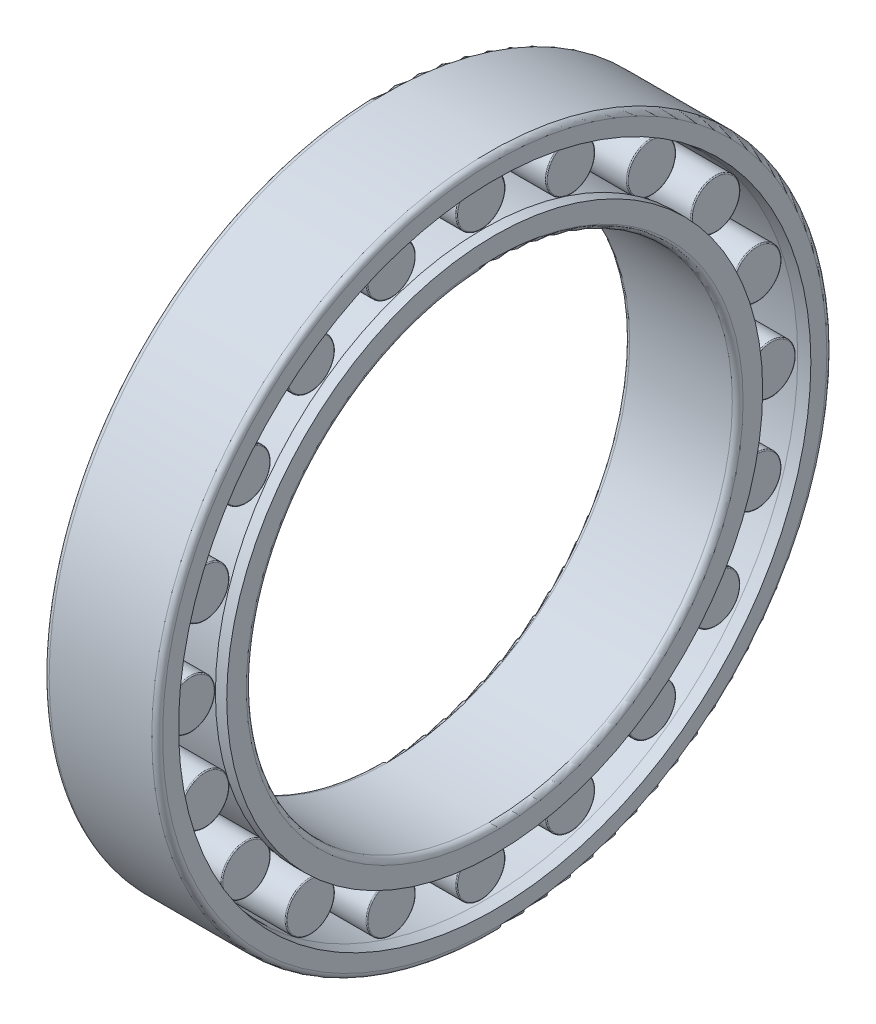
SolidWorks part; units mm, degrees
ref_plane "Plane1" through (0, 0, 0) normal (0, 0, 1) x (1, 0, 0)
ref_plane "Plane2" through (0, 0, 0) normal (0, 1, 0) x (1, 0, 0)
ref_plane "Plane3" through (0, 0, 0) normal (1, 0, 0) x (0, 0, -1)
sketch "Clipboard" plane through (0, 0, 0) normal (0, 0, 1) x (1, 0, 0)
  line L0 (-10, 0) -> (10, 0) construction
  line L1 (0, 0) -> (185.2698, -67.4327)
  line L2 (0, 0) -> (101.017, 36.7672)
  line L3 (0, 0) -> (218.798, -79.636)
  line L4 (0, 0) -> (-22.3471, -0.7804)
sketch "OutRacSke" plane through (0, 0, 0) normal (0, 0, 1) x (1, 0, 0)
  line L0 (16.8, 116.42) -> (21, 117.0867)
  line L1 (-21, 117.0867) -> (-21, 123)
  line L2 (-19, 125) -> (19, 125)
  line L3 (21, 123) -> (21, 117.0867)
  line L4 (-16.8, 116.42) -> (-21, 117.0867)
  line L6 (16.8, 116.42) -> (-16.8, 116.42)
  line L8 (-90, 0) -> (90, 0) construction
  arc A0 (-21, 123) -> (-19, 125) centre (-19, 123) cw
  arc A1 (19, 125) -> (21, 123) centre (19, 123) cw
revolve "OuterRace" add sketch "OutRacSke" angle 360 about L8
sketch "RolDetSke" plane through (0, 0, 0) normal (0, 0, 1) x (1, 0, 0)
  line L0 (-15.96, 116.1851) -> (-15.96, 107.5)
  line L1 (-15.96, 107.5) -> (15.96, 107.5)
  line L2 (15.96, 107.5) -> (15.96, 116.1851)
  line L3 (15.5981, 116.547) -> (-15.5981, 116.547)
  line L4 (-33.6, 107.5) -> (33.6, 107.5) construction
  arc A0 (15.96, 116.1851) -> (15.5981, 116.547) centre (15.5981, 116.1851) ccw
  arc A1 (-15.5981, 116.547) -> (-15.96, 116.1851) centre (-15.5981, 116.1851) ccw
revolve "RollerDetailed" add sketch "RolDetSke" angle 360 about L4
ref_axis "Axis1" through (-50, 0, 0) along (1, 0, 0)
sketch "RolSimSke" plane through (0, 101.6, 0) normal (0, 0, 1) x (1, 0, 0)
  line L0 (-15.96, 14.5851) -> (-15.96, -2.7851)
  line L1 (25.4, -101.6) -> (-25.4, -101.6) construction
  line L2 (15.96, -2.7851) -> (15.96, 14.5851)
  line L3 (15.5981, 14.947) -> (-15.5981, 14.947)
  line L5 (15.5981, -3.147) -> (-15.5981, -3.147)
  arc A0 (15.96, 14.5851) -> (15.5981, 14.947) centre (15.5981, 14.5851) ccw
  arc A1 (-15.5981, 14.947) -> (-15.96, 14.5851) centre (-15.5981, 14.5851) ccw
  arc A2 (15.96, -2.7851) -> (15.5981, -3.147) centre (15.5981, -2.7851) cw
  arc A3 (-15.5981, -3.147) -> (-15.96, -2.7851) centre (-15.5981, -2.7851) cw
revolve "RollersSimplified" [suppressed] add sketch "RolSimSke" angle 360 about L1
sketch "InsRacSke" plane through (0, 0, 0) normal (0, 0, 1) x (1, 0, 0)
  line L0 (16.8, 98.58) -> (16.8, 99.2467)
  line L1 (-21, 99.2467) -> (-21, 92)
  line L2 (-19, 90) -> (19, 90)
  line L3 (21, 92) -> (21, 99.2467)
  line L4 (16.8, 99.2467) -> (21, 99.2467)
  line L5 (16.8, 98.58) -> (-16.8, 98.58)
  line L6 (-90, 0) -> (90, 0) construction
  line L8 (-16.8, 98.58) -> (-16.8, 99.2467)
  line L9 (-16.8, 99.2467) -> (-21, 99.2467)
  arc A0 (-21, 92) -> (-19, 90) centre (-19, 92) ccw
  arc A1 (19, 90) -> (21, 92) centre (19, 92) ccw
revolve "InnerRace" add sketch "InsRacSke" angle 360 about L6
pattern_circular "RollersDetailed" count 20 every 18 about axis through (-50, 0, 0) along (1, 0, 0) of "RollerDetailed"
sketch "CagSpiSke" plane through (0, 0, 0) normal (0, 0, 1) x (1, 0, 0)
  line L0 (18.9, 105.2383) -> (18.9, 109.7618)
  line L1 (18.9, 109.7618) -> (-18.9, 109.7618)
  line L2 (-18.9, 109.7618) -> (-18.9, 105.2383)
  line L3 (-18.9, 105.2383) -> (18.9, 105.2383)
  line L4 (-90, 0) -> (90, 0) construction
revolve "CageSpine" [suppressed] add sketch "CagSpiSke" angle 360 about L4
equation "\"CLdia@Clipboard\" =  ( \"Race_OD@Clipboard\" + \"Race_ID@Clipboard\" )  / 4"
equation "\"Race_OD@OutRacSke\" = \"Race_OD@Clipboard\""
equation "\"halfCylLen@OutRacSke\" = \"Cyl_Len@OutRacSke\" / 2"
equation "\"groove_dp@OutRacSke\" = \"radius@OutRacSke\" / 3"
equation "\"RolCLRad@RolDetSke\" = \"CLdia@Clipboard\""
equation "\"Roller_diameter@RolDetSke\" =  ( \"Race_OD@Clipboard\" - \"Race_ID@Clipboard\" )  / 2 + .01"
equation "\"Roller_diameter@RolSimSke\" =  ( \"Race_OD@Clipboard\" - \"Race_ID@Clipboard\" )  / 2 + .01"
equation "\"radius@RolDetSke\" = \"Roller_diameter@RolDetSke\" / 50"
equation "\"Length@RolDetSke\" = \"Cyl_Len@OutRacSke\" * .95"
equation "\"halfLength@RolDetSke\" = \"Length@RolDetSke\" / 2"
equation "\"thickness@CagSpiSke\"  = \"Roller_diameter@RolDetSke\" * .25"
equation "\"Cag_IR@CagSpiSke\" =  \"RolCLRad@RolDetSke\" * 2 - \"thickness@CagSpiSke\""
equation "\"Rol_Length@RolSimSke\" = \"Cyl_Len@InsRacSke\" * .95"
equation "\"halfLength@RolSimSke\" = \"Rol_Length@RolSimSke\" / 2"
equation "\"radius@RolSimSke\" = \"radius@RolDetSke\""
equation "\"D1@RolSimSke\" = \"CLdia@Clipboard\" -  ( \"Roller_diameter@RolSimSke\" / 2 ) "
equation "\"Max_count@Clipboard\" = int( 3.14159265 / atn(( \"Roller_diameter@RolDetSke\" / 2) / sqr( \"RolCLRad@RolDetSke\"  *  \"RolCLRad@RolDetSke\" - ( \"Roller_diameter@RolDetSke\" / 2) *  ( \"Roller_diameter@RolDetS"
equation "\"Max_count@Clipboard\" = ((sgn( \"Max_count@Clipboard\" - \"Count@Clipboard\" )-1)*( \"Max_count@Clipboard\" - \"Count@Clipboard\" ))/-2+ \"Count@Clipboard\""
equation "\"Count@RollersDetailed\" = int( \"Show_count@Clipboard\" ) "
equation "\"Count@RollersDetailed\" = ((sgn( \"Count@RollersDetailed\" - \"Max_count@Clipboard\" )-1)*( \"Count@RollersDetailed\" - \"Max_count@Clipboard\" ))/-2+ \"Max_count@Clipboard\""
equation "\"Count@RollersDetailed\" = ((sgn( \"Count@RollersDetailed\" - \"Min_count@Clipboard\" )+1)*( \"Count@RollersDetailed\" - \"Min_count@Clipboard\"))/2 +\"Min_count@Clipboard\""
equation "\"Angle@RollersDetailed\" = 360.0 / \"Max_count@Clipboard\""
equation "\"radius@InsRacSke\" = \"radius@OutRacSke\""
equation "\"Width@InsRacSke\" = \"Width@OutRacSke\""
equation "\"halfWidth@OutRacSke\" = \"Width@OutRacSke\" / 2"
equation "\"halfWidth@InsRacSke\" = \"Width@InsRacSke\" / 2"
equation "\"Race_ID@InsRacSke\" = \"Race_ID@Clipboard\""
equation "\"Cyl_Len@InsRacSke\" = \"Cyl_Len@OutRacSke\""
equation "\"halfCylLen@InsRacSke\" = \"Cyl_Len@InsRacSke\" / 2"
equation "\"Angle@CageSpine\" =  \"Angle@RollersDetailed\" * ( \"Count@RollersDetailed\" -1 + int( \"Count@RollersDetailed\" / \"Max_count@Clipboard\" ) )  + 0.001 -  int( \"Count@RollersDetailed\" / \"Max_count@Clipboard\" "
equation "\"Angle@CageSpine\" =  \"Angle@CageSpine\" * int( \"Min_count@Clipboard\" / 2) + int(1 / \"Min_count@Clipboard\")  * 0.001"
equation "\"width@CagSpiSke\" =   ( \"Width@InsRacSke\" + \"Cyl_Len@InsRacSke\" )  / 2"
equation "\"halfwidth@CagSpiSke\" = \"width@CagSpiSke\" / 2"
